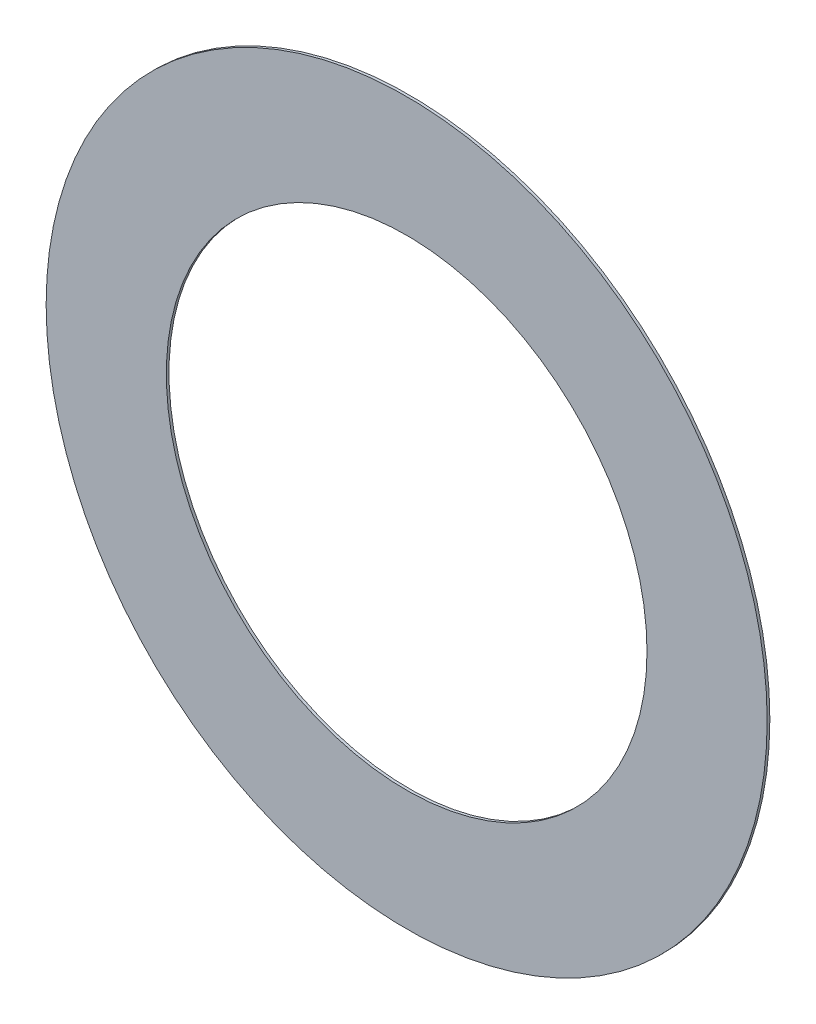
SolidWorks part; units mm, degrees
ref_plane "Front Plane" through (0, 0, 0) normal (0, 0, 1) x (1, 0, 0)
ref_plane "Top Plane" through (0, 0, 0) normal (0, 1, 0) x (1, 0, 0)
ref_plane "Right Plane" through (0, 0, 0) normal (1, 0, 0) x (0, 0, -1)
sketch "Sketch2" plane through (0, 0, 0) normal (0, 0, 1) x (1, 0, 0)
  circle A278 centre (0, 0) radius 4.5
  circle A279 centre (0, 0) radius 6.75
extrude "Boss-Extrude1" add sketch "Sketch2" along normal blind 0.05
